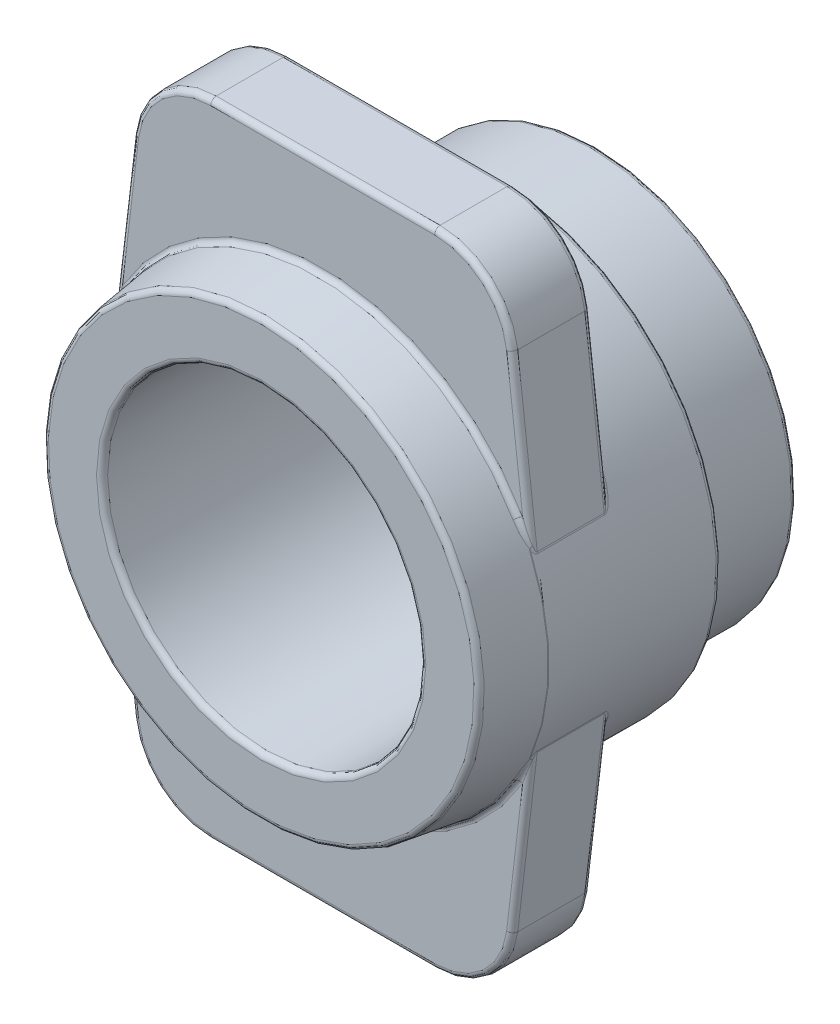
SolidWorks part; units mm, degrees
ref_plane "Face" through (0, 0, 0) normal (0, 0, 1) x (1, 0, 0)
ref_plane "Dessus" through (0, 0, 0) normal (0, 1, 0) x (1, 0, 0)
ref_plane "Droite" through (0, 0, 0) normal (1, 0, 0) x (0, 0, -1)
sketch "Esquisse1" plane through (0, 0, 0) normal (0, 0, 1) x (1, 0, 0)
  line L0 (0, -73.3205) -> (0, 88.7114) construction
  line L1 (-81.0159, 0) -> (84.0086, 0) construction
  line L2 (-20.0515, 57.5) -> (20.0515, 57.5)
  line L3 (-33.9555, 45.1369) -> (-38.7325, 4.5599)
  line L4 (33.9555, 45.1369) -> (38.7325, 4.5599)
  line L5 (33.9555, -45.1369) -> (38.7325, -4.5599)
  line L6 (-20.0515, -57.5) -> (20.0515, -57.5)
  line L7 (-33.9555, -45.1369) -> (-38.7325, -4.5599)
  arc A0 (-38.7325, 4.5599) -> (-38.7325, -4.5599) centre (0, 0) ccw
  arc A1 (-33.9555, 45.1369) -> (-20.0515, 57.5) centre (-20.0515, 43.5) cw
  arc A2 (33.9555, 45.1369) -> (20.0515, 57.5) centre (20.0515, 43.5) ccw
  arc A3 (38.7325, 4.5599) -> (38.7325, -4.5599) centre (0, 0) cw
  arc A4 (33.9555, -45.1369) -> (20.0515, -57.5) centre (20.0515, -43.5) cw
  arc A5 (-33.9555, -45.1369) -> (-20.0515, -57.5) centre (-20.0515, -43.5) ccw
  circle A6 centre (0, 0) radius 30
  point P12 (-32.5, 57.5)
  point P14 (0, 57.5)
  dimension "D2" = 39
  dimension "D4" = 14
  dimension "D5" = 60
  dimension "D1" = 57.5
  dimension "D3" = 32.5
extrude "Extrusion1" add sketch "Esquisse1" along normal blind 14
sketch "Esquisse2" plane through (0, 0, 0) normal (1, 0, 0) x (0, 0, -1)
  line L0 (0, 0) -> (-57, 0) construction
  line L1 (-25, -29.5) -> (-25, -38.1271)
  line L2 (-24.1351, -39.1179) -> (-14, -40.5)
  line L3 (0, -45.1369) -> (0, -4.5599) construction
  line L4 (16.0045, -40.5) -> (-14, -40.5)
  line L5 (17, -39.5) -> (17, -37)
  line L6 (18, -36) -> (34, -36)
  line L7 (35, -35) -> (35, -29.5)
  line L8 (34, -28.5) -> (-24, -28.5)
  line L9 (-14, -45.1369) -> (-14, -4.5599) construction
  arc A0 (-25, -29.5) -> (-24, -28.5) centre (-24, -29.5) cw
  arc A1 (-25, -38.1271) -> (-24.1351, -39.1179) centre (-24, -38.1271) ccw
  arc A3 (17, -39.5) -> (16.0045, -40.5) centre (16, -39.5) cw
  arc A4 (17, -37) -> (18, -36) centre (18, -37) cw
  arc A5 (35, -35) -> (34, -36) centre (34, -35) cw
  arc A6 (34, -28.5) -> (35, -29.5) centre (34, -29.5) cw
  point P14 (-25, -28.5)
  point P17 (-25, -39)
  point P20 (0, -40.5)
  point P25 (17, -36)
  point P28 (35, -36)
  point P31 (35, -28.5)
  dimension "D8" = 1
  dimension "D1" = 40.5
  dimension "D2" = 18
  dimension "D3" = 25
  dimension "D4" = 28.5
  dimension "D5" = 39
  dimension "D6" = 36
  dimension "D7" = 60
revolve "Révolution1" add sketch "Esquisse2" angle 360 about L0
fillet "Congé1" radius 1 20 edges at (-35.7056, -30.271, 0) (-29.3543, -53.9622, 0) (35.7056, -30.271, 0) (29.3543, -53.9622, 0) (-35.7056, -30.271, 14) (-29.3543, -53.9622, 14) (35.7056, -30.271, 14) (29.3543, -53.9622, 14) (35.7056, 30.271, 0) (29.3543, 53.9622, 0) (-35.7056, 30.271, 0) (-29.3543, 53.9622, 0) (35.7056, 30.271, 14) (29.3543, 53.9622, 14) (-35.7056, 30.271, 14) (-29.3543, 53.9622, 14) (0, -57.5, 0) (0, -57.5, 14) (0, 57.5, 0) (0, 57.5, 14)
fillet "Congé2" radius 1 16 edges at (-37.2707, 15.8477, 13.4967) (-37.4557, 15.4052, 7) (-37.4202, 15.4912, 0.7769) (0, 40.5, 0) (37.2707, 15.8477, 0.5033) (37.4557, 15.4052, 7) (37.4202, 15.4912, 13.2231) (37.2707, -15.8477, 13.4967) (37.4557, -15.4052, 7) (37.4202, -15.4912, 0.7769) (0, -40.5, 0) (-37.2707, -15.8477, 0.5033) (-37.4557, -15.4052, 7) (-37.4202, -15.4912, 13.2231) (0, 40.5, 14) (0, -40.5, 14)
fillet "Congé3" radius 1 10 edges at (-37.1036, -16.4623, 13.684) (-37.0911, -16.2718, 13.9758) (-37.1095, 16.4776, 13.6626) (-37.0943, 16.2627, 13.9806) (37.1036, 16.4623, 13.684) (37.0911, 16.2718, 13.9758) (37.1095, -16.4776, 13.6626) (37.0943, -16.2627, 13.9806) (-40.5, 0, 14) (40.5, 0, 14)
